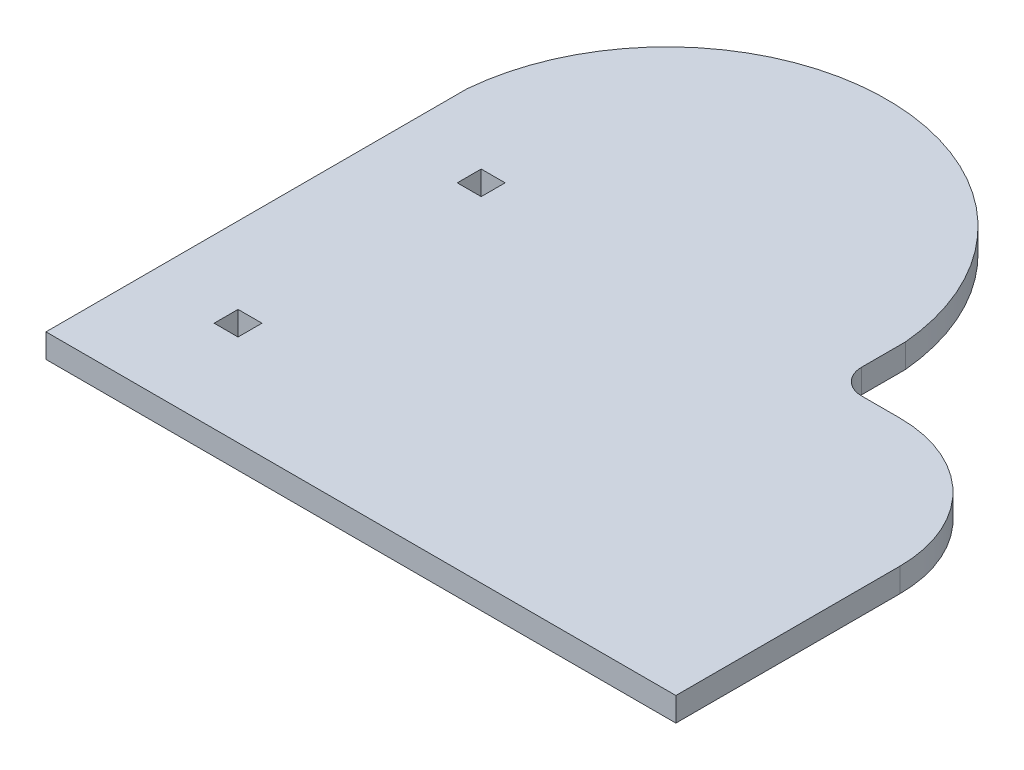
SolidWorks part; units mm, degrees
ref_plane "Front Plane" through (0, 0, 0) normal (0, 0, 1) x (1, 0, 0)
ref_plane "Top Plane" through (0, 0, 0) normal (0, 1, 0) x (1, 0, 0)
ref_plane "Right Plane" through (0, 0, 0) normal (1, 0, 0) x (0, 0, -1)
sketch "circuit outline" plane through (0, 0, 0) normal (0, 1, 0) x (1, 0, 0)
  line L0 (-69.85, 0) -> (-69.85, 15.875)
  line L1 (0, -31.75) -> (-69.85, -31.75)
  line L2 (0, -31.75) -> (0, 0)
  line L3 (0, 0) -> (-17.78, 0)
  line L4 (-69.85, -31.75) -> (-69.85, 0)
  line L5 (-25.4, 15.875) -> (-25.4, 7.62)
  arc A0 (-25.4, 15.875) -> (-69.85, 15.875) centre (-47.625, 15.875) ccw
  arc A1 (-17.78, 0) -> (-25.4, 7.62) centre (-17.78, 7.62) cw
  point P6 (-47.625, 38.1)
  dimension "D3" = 44.45
  dimension "D5" = 7.62
  dimension "D1" = 38.1
  dimension "D2" = 69.85
  dimension "D4" = 31.75
sketch "Sketch2" plane through (0, 0, 0) normal (0, 1, 0) x (1, 0, 0)
  line L0 (0, -31.75) -> (0, 0) construction
  line L1 (0, -31.75) -> (0, 0) construction
  line L2 (0, -31.75) -> (-69.85, -31.75) construction
  line L3 (-69.85, -31.75) -> (-69.85, 0) construction
  line L4 (-69.85, 0) -> (-69.85, 15.875) construction
  line L5 (-25.4, 15.875) -> (-25.4, 7.62) construction
  line L6 (0, 0) -> (-17.78, 0) construction
  line L7 (0, -31.75) -> (-69.85, -31.75) construction
  line L8 (-69.85, -31.75) -> (-69.85, 0) construction
  line L9 (-69.85, 0) -> (-69.85, 15.875) construction
  line L10 (-25.4, 15.875) -> (-25.4, 7.62) construction
  line L11 (0, 0) -> (-17.78, 0) construction
  line L12 (5.08, -36.83) -> (5.08, -10.16)
  line L13 (-10.16, 5.08) -> (-15.24, 5.08)
  line L14 (-20.32, 15.875) -> (-20.32, 10.16)
  line L15 (-74.93, 0) -> (-74.93, 15.875)
  line L16 (-74.93, -36.83) -> (-74.93, 0)
  line L17 (5.08, -36.83) -> (-74.93, -36.83)
  line L18 (-76.708, -39.878) -> (6.858, -39.878)
  line L19 (-76.708, -38.608) -> (6.858, -38.608)
  line L20 (-76.708, -38.608) -> (-76.708, -45.4577)
  line L21 (-18.542, 15.9538) -> (-18.542, 10.16)
  line L22 (-76.708, 0) -> (-76.708, 15.9538)
  line L23 (-76.708, -38.608) -> (-76.708, 0)
  line L24 (6.858, -38.608) -> (-76.708, -38.608)
  line L25 (6.858, -38.608) -> (6.858, -10.16)
  line L26 (-10.16, 6.858) -> (-15.24, 6.858)
  line L27 (-22.098, 14.7785) -> (-22.098, 9.0635)
  line L28 (-73.152, -1.0965) -> (-73.152, 14.7785)
  line L29 (-73.152, -36.1485) -> (-73.152, -1.0965)
  line L30 (3.302, -36.1485) -> (-73.152, -36.1485)
  line L31 (3.302, -36.1485) -> (3.302, -11.2565)
  line L32 (-10.16, 2.2055) -> (-15.24, 2.2055)
  line L33 (-76.708, -45.4577) -> (6.858, -45.4577)
  line L34 (6.858, -38.608) -> (6.858, -45.4577)
  arc A0 (-25.4, 15.875) -> (-69.85, 15.875) centre (-47.625, 15.875) ccw construction
  arc A1 (-25.4, 7.62) -> (-17.78, 0) centre (-17.78, 7.62) ccw construction
  arc A2 (-25.4, 15.875) -> (-69.85, 15.875) centre (-47.625, 15.875) ccw construction
  arc A3 (-25.4, 7.62) -> (-17.78, 0) centre (-17.78, 7.62) ccw construction
  arc A5 (-20.32, 15.875) -> (-74.93, 15.875) centre (-47.625, 13.4126) ccw
  arc A6 (5.08, -10.16) -> (-10.16, 5.08) centre (-10.16, -10.16) ccw
  arc A8 (-15.24, 5.08) -> (-20.32, 10.16) centre (-15.24, 10.16) cw
  arc A9 (-15.24, 6.858) -> (-18.542, 10.16) centre (-15.24, 10.16) cw
  arc A10 (-18.542, 15.9538) -> (-76.708, 15.9538) centre (-47.625, 13.4126) ccw
  arc A11 (6.858, -10.16) -> (-10.16, 6.858) centre (-10.16, -10.16) ccw
  arc A12 (-15.24, 2.2055) -> (-22.098, 9.0635) centre (-15.24, 9.0635) cw
  arc A13 (-22.098, 14.7785) -> (-73.152, 14.7785) centre (-47.625, 13.335) ccw
  arc A14 (3.302, -11.2565) -> (-10.16, 2.2055) centre (-10.16, -11.2565) ccw
  dimension "D2" = 15.24
  dimension "D3" = 5.08
  dimension "D1" = 6.8497
  dimension "D5" = 2.54
  dimension "D6" = 1.27
  dimension "D4" = 1.778
extrude "lid" add sketch "Sketch2" along normal blind 3.175 contours L34 L19 L20 L18 | L22 A10 L21 A9 L26 A11 L25 L24 L23
sketch "Sketch3" plane through (0, 3.175, 0) normal (0, 1, 0) x (1, 0, 0)
  line L0 (-76.708, 15.9538) -> (-76.708, -39.878) construction
  line L1 (-66.548, 7.6988) -> (-63.373, 7.6988)
  line L2 (-66.548, 7.6988) -> (-66.548, 4.5238)
  line L3 (-66.548, 4.5238) -> (-63.373, 4.5238)
  line L4 (-63.373, 7.6988) -> (-63.373, 4.5238)
  line L6 (-66.548, -24.5592) -> (-63.373, -24.5592)
  line L7 (-66.548, -24.5592) -> (-66.548, -27.7342)
  line L8 (-66.548, -27.7342) -> (-63.373, -27.7342)
  line L9 (-63.373, -24.5592) -> (-63.373, -27.7342)
  point P4 (-66.548, 6.1113)
  dimension "D1" = 3.175
  dimension "D2" = 8.255
  dimension "D3" = 10.16
  dimension "D4" = 32.258
  dimension "D5" = 3.175
extrude "hinge slots" cut sketch "Sketch3" against normal through all
